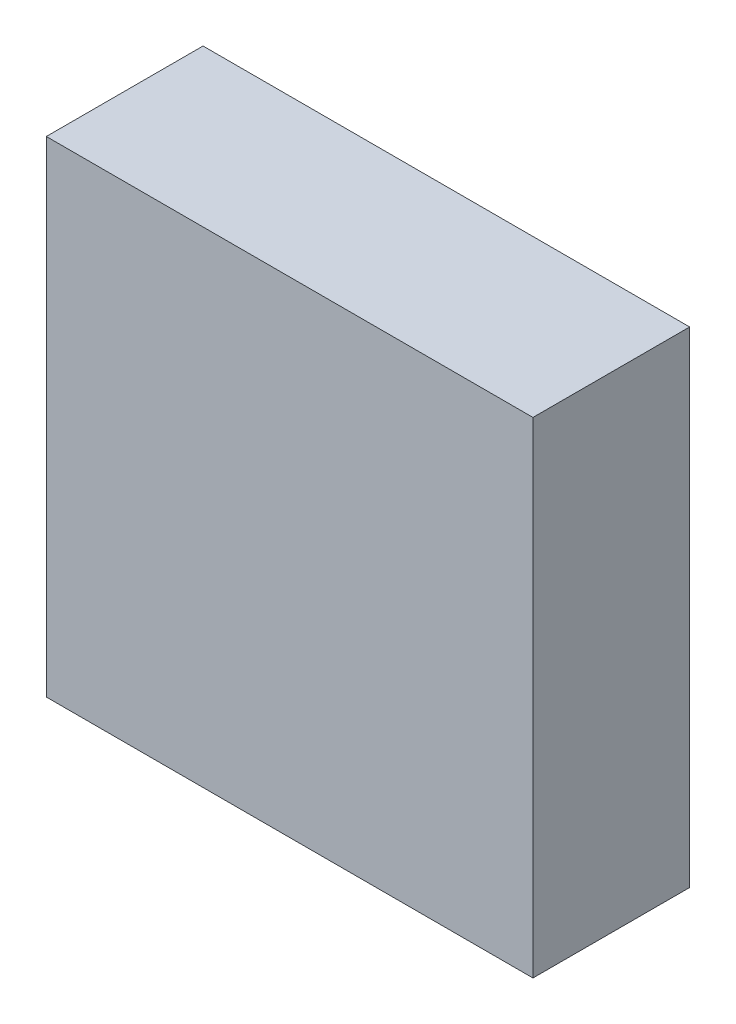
SolidWorks part; units mm, degrees
ref_plane "Plan1" through (0, 0, 0) normal (0, 0, 1) x (1, 0, 0)
ref_plane "Plan2" through (0, 0, 0) normal (0, 1, 0) x (1, 0, 0)
ref_plane "Plan3" through (0, 0, 0) normal (1, 0, 0) x (0, 0, -1)
sketch "Esquisse1" plane through (0, 0, 0) normal (0, 0, 1) x (1, 0, 0)
  circle A0 centre (0, 0) radius 9
  dimension "D1" = 18
extrude "Base-Extru.-Mince" add sketch "Esquisse1" along normal mid plane 0.8 thin
sketch "Esquisse2" plane through (0, 0, 0) normal (0, 0, 1) x (1, 0, 0)
  line L0 (0, 1.0573) -> (0, 12.0999) construction
  line L2 (0, 11.4) -> (0, 6.6)
  arc A1 (0, 11.4) -> (0, 6.6) centre (0, 9) ccw
  dimension "D2" = 2.4
  dimension "D1" = 9
revolve "Boss.-Révol.1" add sketch "Esquisse2" angle 360 about L0
sketch "Esquisse3" plane through (0, 0, 0) normal (0, 0, 1) x (1, 0, 0)
  line L0 (0, 12.2917) -> (0, 1.0573) construction
  line L1 (0, 1.0573) -> (0, 12.0999) construction
  line L2 (0, 7) -> (0, 11)
  arc A0 (0, 11) -> (0, 7) centre (0, 9) ccw
  arc A1 (2.3922, 9.1939) -> (-2.3922, 9.1939) centre (0, 9) ccw construction
  dimension "D1" = 2
revolve "Enlèvement de matière-Révolution2" cut sketch "Esquisse3" angle 360 about L0
pattern_circular "Répétition circulaire1" count 7 over 360 about axis through (0, 0, 0) along (0, 0, 1) of "Boss.-Révol.1", "Enlèvement de matière-Révolution2"
sketch "Esquisse4" plane through (0, 0, 0) normal (0, 0, 1) x (1, 0, 0)
  circle A0 centre (0, 0) radius 8.5018
  circle A1 centre (0, 0) radius 9.5586
extrude "Enlèv. mat.-Extru.1" cut sketch "Esquisse4" against normal mid plane 10 flip side to cut
